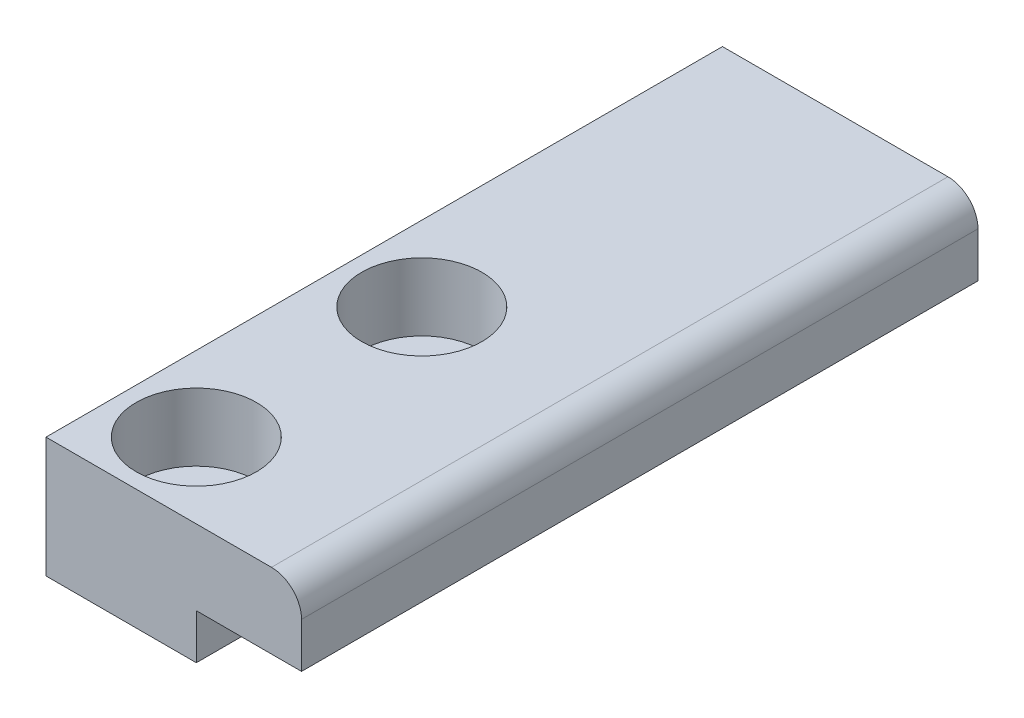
SolidWorks part; units mm, degrees
ref_plane "前视基准面" through (0, 0, 0) normal (0, 0, 1) x (1, 0, 0)
ref_plane "上视基准面" through (0, 0, 0) normal (0, 1, 0) x (1, 0, 0)
ref_plane "右视基准面" through (0, 0, 0) normal (1, 0, 0) x (0, 0, -1)
sketch "草图1" plane through (0, 0, 0) normal (0, 0, 1) x (1, 0, 0)
  line L0 (0, 0) -> (0, 8)
  line L1 (10, 0) -> (10, 3)
  line L2 (17, 3) -> (17, 6)
  line L3 (10, 3) -> (17, 3)
  line L4 (0, 8) -> (15, 8)
  line L5 (0, 0) -> (10, 0)
  arc A0 (17, 6) -> (15, 8) centre (15, 6) ccw
extrude "凸台-拉伸1" add sketch "草图1" along normal blind 45
sketch "草图2" plane through (0, 8, 0) normal (0, 1, 0) x (1, 0, 0)
  circle A0 centre (5, -40) radius 2.25
  circle A1 centre (5, -25) radius 2.25
extrude "切除-拉伸1" cut sketch "草图2" against normal blind 45
sketch "草图3" plane through (0, 8, 0) normal (0, 1, 0) x (1, 0, 0)
  circle A0 centre (5, -40) radius 4
  circle A1 centre (5, -25) radius 4
extrude "切除-拉伸2" cut sketch "草图3" against normal blind 4.5
